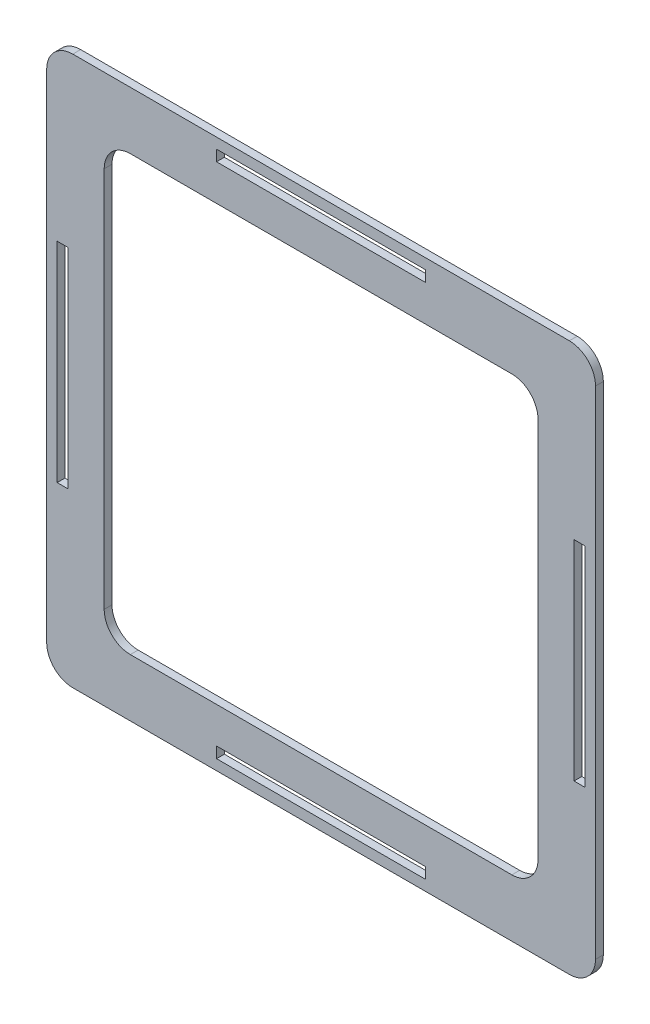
SolidWorks part; units mm, degrees
ref_plane "Plan de face" through (0, 0, 0) normal (0, 0, 1) x (1, 0, 0)
ref_plane "Plan de dessus" through (0, 0, 0) normal (0, 1, 0) x (1, 0, 0)
ref_plane "Plan de droite" through (0, 0, 0) normal (1, 0, 0) x (0, 0, -1)
sketch "Esquisse1" plane through (0, 0, 0) normal (0, 0, 1) x (1, 0, 0)
  line L0 (-52.5, 52.5) -> (52.5, -52.5) construction
  line L5 (-47.5, 52.5) -> (47.5, 52.5)
  line L14 (-52.5, 47.5) -> (-52.5, -47.5)
  line L15 (-47.5, -52.5) -> (47.5, -52.5)
  line L24 (52.5, 47.5) -> (52.5, -47.5)
  line L25 (0, 0) -> (-76.9343, 0) construction
  line L26 (-50.5, 20) -> (-48.4, 20)
  line L27 (-50.5, 20) -> (-50.5, -20)
  line L28 (-50.5, -20) -> (-48.4, -20)
  line L29 (-48.4, 20) -> (-48.4, -20)
  line L30 (20, 50.5) -> (20, 48.4)
  line L31 (20, 50.5) -> (-20, 50.5)
  line L32 (-20, 50.5) -> (-20, 48.4)
  line L33 (20, 48.4) -> (-20, 48.4)
  line L34 (50.5, -20) -> (48.4, -20)
  line L35 (50.5, -20) -> (50.5, 20)
  line L36 (50.5, 20) -> (48.4, 20)
  line L37 (48.4, -20) -> (48.4, 20)
  line L38 (-20, -50.5) -> (-20, -48.4)
  line L39 (-20, -50.5) -> (20, -50.5)
  line L40 (20, -50.5) -> (20, -48.4)
  line L41 (-20, -48.4) -> (20, -48.4)
  line L42 (0, 40.3899) -> (0, -40.9372) construction
  line L43 (-36.5, 41.5) -> (36.5, 41.5)
  line L44 (-41.5, 36.5) -> (-41.5, -36.5)
  line L45 (-36.5, -41.5) -> (36.5, -41.5)
  line L46 (41.5, 36.5) -> (41.5, -36.5)
  arc A0 (-41.5, -36.5) -> (-36.5, -41.5) centre (-36.5, -36.5) ccw
  arc A1 (36.5, -41.5) -> (41.5, -36.5) centre (36.5, -36.5) ccw
  arc A2 (36.5, 41.5) -> (41.5, 36.5) centre (36.5, 36.5) cw
  arc A3 (-41.5, 36.5) -> (-36.5, 41.5) centre (-36.5, 36.5) cw
  arc A4 (47.5, -52.5) -> (52.5, -47.5) centre (47.5, -47.5) ccw
  arc A5 (-52.5, -47.5) -> (-47.5, -52.5) centre (-47.5, -47.5) ccw
  arc A6 (47.5, 52.5) -> (52.5, 47.5) centre (47.5, 47.5) cw
  arc A7 (-47.5, 52.5) -> (-52.5, 47.5) centre (-47.5, 47.5) ccw
  point P35 (41.5, 41.5)
  point P38 (-41.5, 41.5)
  point P46 (52.5, 52.5)
  dimension "D7" = 5
  dimension "D8" = 5
  dimension "D1" = 105
  dimension "D2" = 2.1
  dimension "D3" = 40
  dimension "D4" = 2
  dimension "D5" = 4
  dimension "D6" = 83
extrude "Boss.-Extru.1" add sketch "Esquisse1" along normal blind 1.5
